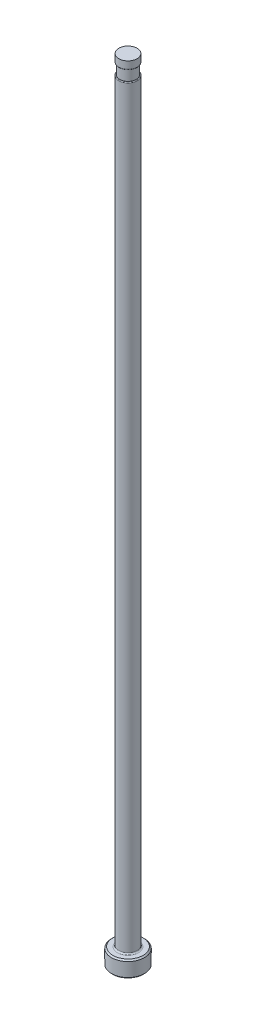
SolidWorks part; units mm, degrees
ref_plane "Front Plane" through (0, 0, 0) normal (0, 0, 1) x (1, 0, 0)
ref_plane "Top Plane" through (0, 0, 0) normal (0, 1, 0) x (1, 0, 0)
ref_plane "Right Plane" through (0, 0, 0) normal (1, 0, 0) x (0, 0, -1)
other "Configuration Table"
sketch "Sketch1" plane through (0, 0, 0) normal (0, 0, 1) x (1, 0, 0)
  line L0 (0, 259.9588) -> (0, -15.1925) construction
  line L1 (0, 0) -> (-3.175, 0)
  line L2 (-3.175, 0) -> (-3.175, 3.175)
  line L3 (-3.175, 3.175) -> (-1.7856, 3.175)
  line L4 (-1.7856, 3.175) -> (-1.7856, 152.4)
  line L5 (-1.7856, 152.4) -> (0, 152.4)
  line L6 (0, 152.4) -> (0, 0)
  dimension "L" = 152.4
  dimension "H" = 6.35
  dimension "T" = 3.175
  dimension "D" = 3.5712
revolve "Revolve1" add sketch "Sketch1" angle 360 about L0
chamfer "Chamfer1" distance 0.254 angle 45 2 edges at (0, 3.175, 3.175) (0, 0, 3.175)
fillet "Fillet1" radius 0.254 1 edges at (0, 3.175, 1.7856)
sketch "Sketch2" plane through (0, 0, 0) normal (0, 0, 1) x (1, 0, 0)
  line L0 (-1.7856, 152.4) -> (-1.7856, 3.429) construction
  line L1 (-1.7856, 150.876) -> (-1.5824, 150.876)
  line L2 (-1.7856, 150.876) -> (-1.7856, 148.844)
  line L3 (-1.7856, 148.844) -> (-1.5824, 148.844)
  line L4 (-1.5824, 150.876) -> (-1.5824, 148.844)
  line L5 (1.7856, 152.4) -> (-1.7856, 152.4) construction
  line L6 (0, 153.4483) -> (0, 147.3282) construction
  dimension "D1" = 2.032
  dimension "N" = 1.524
  dimension "FD" = 0.2032
  dimension "D3" = 3.1648
revolve "Vent Relief" cut sketch "Sketch2" angle 360 about L6
sketch "Sketch3" plane through (0, 0, 0) normal (0, 0, 1) x (1, 0, 0)
  line L0 (-1.5824, 149.86) -> (-1.5824, 86.36)
  line L1 (-1.5824, 150.876) -> (-1.5824, 148.844) construction
  line L2 (-1.7856, 148.844) -> (-1.7856, 3.429) construction
  line L3 (-1.7856, 85.2424) -> (-1.7856, 149.86)
  line L4 (-1.7856, 149.86) -> (-1.5824, 149.86)
  arc A0 (-1.5824, 86.36) -> (-1.7856, 85.2424) centre (-4.7574, 86.36) cw
  dimension "D1" = 3.175
  dimension "D2" = 63.5
extrude "D-Slot" cut sketch "Sketch3" against normal through all both and the other way through all
sketch "Sketch5" plane through (0, 0, 0) normal (0, 0, 1) x (1, 0, 0)
  line L0 (-1.7856, 150.876) -> (1.7856, 150.876) construction
  line L1 (-1.7856, 152.4) -> (-1.7602, 152.4)
  line L2 (-1.7856, 152.4) -> (-1.7856, 150.876)
  line L3 (-1.7856, 150.876) -> (-1.7602, 150.876)
  line L4 (-1.7602, 152.4) -> (-1.7602, 150.876)
  line L5 (0, 152.6877) -> (0, 150.5771) construction
  dimension "VP" = 0.0254
revolve "Vent Diameter" cut sketch "Sketch5" angle 360 about L5
fillet "Fillet2" radius 0.127 2 edges at (1.7856, 148.844, 0) (0, 150.876, 1.7602)
sketch "Pocket Sketch" plane through (0, 0, 0) normal (0, 0, 1) x (1, 0, 0)
  line L0 (-3.5719, 0) -> (-3.5719, 3.2004)
  line L1 (-3.5719, 3.2004) -> (-2.7461, 3.2004)
  line L2 (-1.9841, 3.9624) -> (-1.9841, 22.225)
  line L3 (-1.9841, 22.225) -> (0, 22.225)
  line L4 (0, 22.225) -> (0, 0)
  line L5 (0, 0) -> (-3.5719, 0)
  line L6 (0, 12.6104) -> (0, -2.4989) construction
  line L7 (-3.175, 2.921) -> (-3.175, 0.254) construction
  line L8 (2.921, 3.175) -> (-2.921, 3.175) construction
  line L9 (-1.7856, 85.2424) -> (-1.7856, 3.429) construction
  line L10 (-2.7461, 3.2004) -> (-1.9841, 3.9624)
  point P3 (-1.9841, 3.2004)
  dimension "D1" = 7.1437
  dimension "D2" = 0.3969
  dimension "D3" = 0.0254
  dimension "D4" = 0.1984
  dimension "D5" = 3.9681
  dimension "D6" = 22.225
